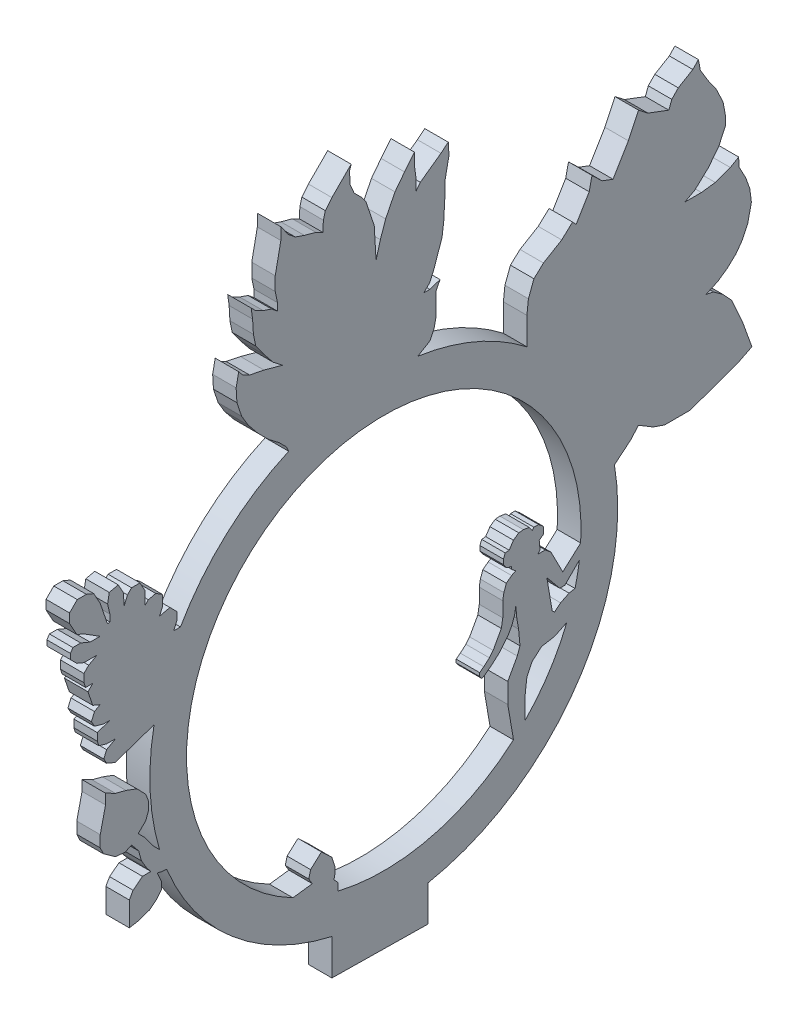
SolidWorks part; units mm, degrees
ref_plane "Plano frontal" through (0, 0, 0) normal (0, 0, 1) x (1, 0, 0)
ref_plane "Plano superior" through (0, 0, 0) normal (0, 1, 0) x (1, 0, 0)
ref_plane "Plano direito" through (0, 0, 0) normal (1, 0, 0) x (0, 0, -1)
sketch "Esboço1" plane through (0, 0, 0) normal (1, 0, 0) x (0, 0, -1)
  line L0 (314.6685, 952.5476) -> (880.0018, 952.5476) construction
  line L1 (226.0307, 496.3943) -> (227.4793, 496.2376)
  line L2 (226.0307, 496.3943) -> (225.0181, 496.664)
  line L3 (225.0181, 496.664) -> (225.5244, 495.5665)
  line L4 (225.5244, 495.5665) -> (226.1393, 494.2335)
  line L5 (226.1393, 494.2335) -> (226.1393, 492.4215)
  line L6 (226.1393, 492.4215) -> (224.673, 490.6933)
  line L7 (224.673, 490.6933) -> (223.0945, 489.4418)
  line L8 (223.0945, 489.4418) -> (220.1515, 488.4404)
  line L9 (220.1515, 488.4404) -> (217.9161, 488.0594)
  line L10 (217.9161, 488.0594) -> (217.9161, 490.0675)
  line L11 (217.9161, 490.0675) -> (217.9161, 492.4215)
  line L12 (217.9161, 492.4215) -> (217.9161, 494.2335)
  line L13 (217.9161, 494.2335) -> (218.8799, 495.9021)
  line L14 (218.8799, 495.9021) -> (220.3037, 497.031)
  line L15 (220.3037, 497.031) -> (221.264, 497.7923)
  line L16 (221.264, 497.7923) -> (222.3516, 497.7923)
  line L17 (222.3516, 497.7923) -> (223.415, 497.7923)
  line L18 (223.415, 497.7923) -> (222.3516, 499.0984)
  line L19 (222.3516, 499.0984) -> (221.0181, 501.3378)
  line L20 (221.0181, 501.3378) -> (220.3037, 503.8906)
  line L21 (220.3037, 503.8906) -> (218.4927, 506.1149)
  line L22 (218.4927, 506.1149) -> (216.8457, 505.3501)
  line L23 (216.8457, 505.3501) -> (214.394, 505.5554)
  line L24 (214.394, 505.5554) -> (211.2787, 507.7765)
  line L25 (211.2787, 507.7765) -> (210.4915, 509.4718)
  line L26 (210.4915, 509.4718) -> (210.4915, 512.4023)
  line L27 (210.4915, 512.4023) -> (211.2787, 515.8271)
  line L28 (211.2787, 515.8271) -> (211.8425, 518.2799)
  line L29 (211.8425, 518.2799) -> (211.8425, 520.8947)
  line L30 (211.8425, 520.8947) -> (214.394, 519.5873)
  line L31 (214.394, 519.5873) -> (217.0721, 518.8876)
  line L32 (217.0721, 518.8876) -> (219.8557, 517.8482)
  line L33 (219.8557, 517.8482) -> (222.0914, 515.5605)
  line L34 (222.0914, 515.5605) -> (222.7723, 513.8107)
  line L35 (222.7723, 513.8107) -> (222.7723, 511.4552)
  line L36 (222.7723, 511.4552) -> (222.0914, 509.6315)
  line L37 (222.0914, 509.6315) -> (220.644, 508.2171)
  line L38 (220.644, 508.2171) -> (220.1932, 507.7765)
  line L39 (220.1932, 507.7765) -> (221.9748, 505.9535)
  line L40 (221.9748, 505.9535) -> (224.0695, 503.1016)
  line L41 (224.0695, 503.1016) -> (225.6449, 501.4895)
  line L42 (229.271, 548.0954) -> (230.9765, 548.0954)
  line L43 (229.271, 548.0954) -> (230.1237, 550.1282)
  line L44 (230.1237, 550.1282) -> (230.1237, 551.9149)
  line L45 (230.1237, 551.9149) -> (228.2793, 553.7593)
  line L46 (228.2793, 553.7593) -> (225.6449, 553.1468)
  line L47 (225.6449, 553.1468) -> (226.3872, 554.9164)
  line L48 (226.3872, 554.9164) -> (226.3872, 557.5866)
  line L49 (226.3872, 557.5866) -> (224.673, 558.6612)
  line L50 (224.673, 558.6612) -> (222.7723, 558.2193)
  line L51 (222.7723, 558.2193) -> (221.9748, 557.4217)
  line L52 (221.9748, 557.4217) -> (221.9748, 560.6046)
  line L53 (221.9748, 560.6046) -> (220.644, 563.006)
  line L54 (220.644, 563.006) -> (218.4927, 563.006)
  line L55 (218.4927, 563.006) -> (217.4416, 561.9549)
  line L56 (217.4416, 561.9549) -> (216.6007, 559.9503)
  line L57 (216.6007, 559.9503) -> (216.3904, 563.006)
  line L58 (216.3904, 563.006) -> (215.084, 565.3636)
  line L59 (215.084, 565.3636) -> (212.7983, 564.8322)
  line L60 (212.7983, 564.8322) -> (212.3649, 562.4805)
  line L61 (212.3649, 562.4805) -> (212.9532, 559.9503)
  line L62 (212.9532, 559.9503) -> (212.9532, 558.2193)
  line L63 (212.9532, 558.2193) -> (212.3491, 558.0789)
  line L64 (212.3491, 558.0789) -> (211.2787, 561.2154)
  line L65 (211.2787, 561.2154) -> (210.4457, 563.6563)
  line L66 (210.4457, 563.6563) -> (208.8513, 566.5335)
  line L67 (208.8513, 566.5335) -> (206.9493, 567.3314)
  line L68 (206.9493, 567.3314) -> (204.6251, 567.3314)
  line L69 (204.6251, 567.3314) -> (202.6573, 565.3636)
  line L70 (202.6573, 565.3636) -> (202.6573, 563.006)
  line L71 (202.6573, 563.006) -> (203.5039, 561.4782)
  line L72 (203.5039, 561.4782) -> (204.5186, 559.6471)
  line L73 (204.5186, 559.6471) -> (206.2431, 558.9237)
  line L74 (206.2431, 558.9237) -> (208.8513, 557.2886)
  line L75 (208.8513, 557.2886) -> (210.4457, 556.2891)
  line L76 (210.4457, 556.2891) -> (207.9003, 556.2891)
  line L77 (207.9003, 556.2891) -> (205.5176, 557.2886)
  line L78 (205.5176, 557.2886) -> (203.5039, 557.2886)
  line L79 (203.5039, 557.2886) -> (202.8773, 556.2891)
  line L80 (202.8773, 556.2891) -> (202.8773, 554.9164)
  line L81 (202.8773, 554.9164) -> (204.5108, 553.2829)
  line L82 (204.5108, 553.2829) -> (206.3207, 552.5236)
  line L83 (206.3207, 552.5236) -> (208.3877, 552.5236)
  line L84 (208.3877, 552.5236) -> (209.6485, 552.5236)
  line L85 (209.6485, 552.5236) -> (207.5389, 551.3546)
  line L86 (207.5389, 551.3546) -> (206.3207, 550.1364)
  line L87 (206.3207, 550.1364) -> (206.3207, 548.0954)
  line L88 (206.3207, 548.0954) -> (206.7581, 546.8136)
  line L89 (206.7581, 546.8136) -> (208.5937, 546.8136)
  line L90 (208.5937, 546.8136) -> (207.3542, 545.5741)
  line L91 (207.3542, 545.5741) -> (207.9003, 543.9738)
  line L92 (207.9003, 543.9738) -> (208.5937, 541.942)
  line L93 (208.5937, 541.942) -> (210.4457, 541.165)
  line L94 (210.4457, 541.165) -> (209.0181, 540.3739)
  line L95 (209.0181, 540.3739) -> (208.2375, 538.5133)
  line L96 (208.2375, 538.5133) -> (209.0181, 537.1047)
  line L97 (209.0181, 537.1047) -> (211.2787, 536.4562)
  line L98 (211.2787, 536.4562) -> (212.9532, 536.4562)
  line L99 (212.9532, 536.4562) -> (209.7319, 535.3569)
  line L100 (209.7319, 535.3569) -> (209.7319, 533.4406)
  line L101 (209.7319, 533.4406) -> (210.1484, 532.2202)
  line L102 (210.1484, 532.2202) -> (212.1159, 531.6557)
  line L103 (212.1159, 531.6557) -> (214.394, 531.6557)
  line L104 (214.394, 531.6557) -> (212.1159, 530.3933)
  line L105 (212.1159, 530.3933) -> (211.3941, 528.6726)
  line L106 (211.3941, 528.6726) -> (212.1159, 527.37)
  line L107 (212.1159, 527.37) -> (214.2987, 526.4543)
  line L108 (214.2987, 526.4543) -> (215.6403, 526.9121)
  line L109 (215.6403, 526.9121) -> (218.2728, 527.8105)
  line L110 (218.2728, 527.8105) -> (220.644, 528.6197)
  line L111 (220.644, 528.6197) -> (224.2371, 529.846)
  line L112 (294.6744, 579.5011) -> (291.6024, 577.667)
  line L113 (294.6744, 579.5011) -> (295.769, 581.6984)
  line L114 (295.769, 581.6984) -> (296.2584, 584.1219)
  line L115 (296.2584, 584.1219) -> (296.2584, 586.9013)
  line L116 (296.2584, 586.9013) -> (296.2584, 589.7394)
  line L117 (296.2584, 589.7394) -> (297.2801, 591.7906)
  line L118 (297.2801, 591.7906) -> (294.6744, 590.9177)
  line L119 (294.6744, 590.9177) -> (293.1384, 590.9177)
  line L120 (293.1384, 590.9177) -> (294.6744, 592.4537)
  line L121 (294.6744, 592.4537) -> (295.769, 594.997)
  line L122 (295.769, 594.997) -> (296.7693, 597.9047)
  line L123 (296.7693, 597.9047) -> (297.7957, 600.8885)
  line L124 (297.7957, 600.8885) -> (298.228, 604.215)
  line L125 (298.228, 604.215) -> (298.4491, 608.2317)
  line L126 (298.4491, 608.2317) -> (298.6014, 610.9992)
  line L127 (298.6014, 610.9992) -> (298.6014, 613.3113)
  line L128 (298.6014, 613.3113) -> (299.2076, 616.3129)
  line L129 (299.2076, 616.3129) -> (299.5664, 618.0897)
  line L130 (299.5664, 618.0897) -> (299.387, 621.1313)
  line L131 (299.387, 621.1313) -> (297.5121, 619.6105)
  line L132 (297.5121, 619.6105) -> (294.6744, 617.5676)
  line L133 (294.6744, 617.5676) -> (292.248, 615.8207)
  line L134 (292.248, 615.8207) -> (291.1177, 614.3512)
  line L135 (291.1177, 614.3512) -> (291.1177, 617.5676)
  line L136 (291.1177, 617.5676) -> (290.7592, 620.1246)
  line L137 (290.7592, 620.1246) -> (290.7592, 623.2393)
  line L138 (290.7592, 623.2393) -> (288.2265, 620.1246)
  line L139 (288.2265, 620.1246) -> (285.7743, 616.9368)
  line L140 (285.7743, 616.9368) -> (283.3926, 612.1552)
  line L141 (283.3926, 612.1552) -> (282.0428, 608.2317)
  line L142 (282.0428, 608.2317) -> (280.9412, 604.215)
  line L143 (280.9412, 604.215) -> (280.6464, 609.2117)
  line L144 (280.6464, 609.2117) -> (280.4728, 612.1552)
  line L145 (280.4728, 612.1552) -> (279.4464, 615.219)
  line L146 (279.4464, 615.219) -> (278.337, 618.5307)
  line L147 (278.337, 618.5307) -> (277.3984, 619.8343)
  line L148 (277.3984, 619.8343) -> (275.3376, 621.8951)
  line L149 (275.3376, 621.8951) -> (274.3389, 624.2432)
  line L150 (274.3389, 624.2432) -> (274.1526, 627.4016)
  line L151 (274.1526, 627.4016) -> (274.5854, 628.6599)
  line L152 (274.5854, 628.6599) -> (271.5914, 625.6658)
  line L153 (271.5914, 625.6658) -> (269.6598, 623.7343)
  line L154 (269.6598, 623.7343) -> (267.9911, 621.6819)
  line L155 (267.9911, 621.6819) -> (267.4843, 619.8343)
  line L156 (267.4843, 619.8343) -> (267.3394, 617.2013)
  line L157 (267.3394, 617.2013) -> (265.5558, 618.0897)
  line L158 (265.5558, 618.0897) -> (262.628, 618.8927)
  line L159 (262.628, 618.8927) -> (260.3249, 619.685)
  line L160 (260.3249, 619.685) -> (258.5461, 621.1313)
  line L161 (258.5461, 621.1313) -> (256.6195, 623.8075)
  line L162 (256.6195, 623.8075) -> (256.6195, 620.7581)
  line L163 (256.6195, 620.7581) -> (255.7477, 616.4417)
  line L164 (255.7477, 616.4417) -> (255.1914, 613.6871)
  line L165 (255.1914, 613.6871) -> (255.1914, 610.1935)
  line L166 (255.1914, 610.1935) -> (255.7477, 607.4556)
  line L167 (255.7477, 607.4556) -> (255.7477, 605.5759)
  line L168 (255.7477, 605.5759) -> (254.2637, 606.7826)
  line L169 (254.2637, 606.7826) -> (252.0977, 607.5278)
  line L170 (252.0977, 607.5278) -> (250.163, 608.4915)
  line L171 (250.163, 608.4915) -> (249.039, 609.6155)
  line L172 (249.039, 609.6155) -> (249.4088, 606.9775)
  line L173 (249.4088, 606.9775) -> (249.6127, 603.5206)
  line L174 (249.6127, 603.5206) -> (250.198, 600.64)
  line L175 (250.198, 600.64) -> (252.3077, 597.7096)
  line L176 (252.3077, 597.7096) -> (254.6567, 594.8137)
  line L177 (254.6567, 594.8137) -> (257.0855, 592.9453)
  line L178 (257.0855, 592.9453) -> (252.3077, 594.2557)
  line L179 (252.3077, 594.2557) -> (248.6367, 594.997)
  line L180 (248.6367, 594.997) -> (246.8705, 595.8768)
  line L181 (246.8705, 595.8768) -> (245.857, 597.1264)
  line L182 (245.857, 597.1264) -> (245.2012, 593.8795)
  line L183 (245.2012, 593.8795) -> (245.4012, 590.49)
  line L184 (245.4012, 590.49) -> (246.6035, 586.9013)
  line L185 (246.6035, 586.9013) -> (248.2629, 584.1219)
  line L186 (248.2629, 584.1219) -> (250.7067, 581.109)
  line L187 (250.7067, 581.109) -> (253.4822, 578.3335)
  line L188 (253.4822, 578.3335) -> (256.1836, 576.2554)
  line L189 (256.1836, 576.2554) -> (258.0706, 574.3684)
  line L190 (264.665, 474.4605) -> (259.7084, 473.8246)
  line L191 (264.665, 474.4605) -> (263.7635, 475.9377)
  line L192 (263.7635, 475.9377) -> (264.2142, 477.8)
  line L193 (264.2142, 477.8) -> (267.0019, 480.3155)
  line L194 (267.0019, 480.3155) -> (269.6598, 477.8)
  line L195 (269.6598, 477.8) -> (270.4752, 475.1991)
  line L196 (270.4752, 475.1991) -> (270.4752, 473.8246)
  line L197 (270.4752, 473.8246) -> (270.1762, 472.5893)
  line L198 (270.1762, 472.5893) -> (271.2643, 471.3835)
  line L199 (271.2643, 471.3835) -> (271.2643, 469.5275)
  line L200 (319.4649, 568.8907) -> (319.4649, 565.8203)
  line L201 (319.4649, 568.8907) -> (319.4649, 572.7931)
  line L202 (319.4649, 572.7931) -> (319.8616, 576.2554)
  line L203 (319.8616, 576.2554) -> (321.2653, 579.98)
  line L204 (321.2653, 579.98) -> (323.7053, 582.2442)
  line L205 (323.7053, 582.2442) -> (328.3613, 585.0185)
  line L206 (328.3613, 585.0185) -> (331.1301, 587.5879)
  line L207 (331.1301, 587.5879) -> (332.044, 586.6031)
  line L208 (332.044, 586.6031) -> (333.7582, 589.466)
  line L209 (333.7582, 589.466) -> (335.375, 592.1661)
  line L210 (335.375, 592.1661) -> (336.098, 595.4242)
  line L211 (336.098, 595.4242) -> (338.6626, 592.9453)
  line L212 (338.6626, 592.9453) -> (340.73, 592.1661)
  line L213 (340.73, 592.1661) -> (341.4738, 591.8858)
  line L214 (341.4738, 591.8858) -> (342.7135, 593.9562)
  line L215 (342.7135, 593.9562) -> (345.3904, 598.4268)
  line L216 (345.3904, 598.4268) -> (347.9672, 603.9288)
  line L217 (347.9672, 603.9288) -> (350.3868, 602.0525)
  line L218 (350.3868, 602.0525) -> (353.7499, 600.785)
  line L219 (353.7499, 600.785) -> (355.7248, 600.0407)
  line L220 (355.7248, 600.0407) -> (356.483, 602.0525)
  line L221 (356.483, 602.0525) -> (358.1389, 603.7657)
  line L222 (358.1389, 603.7657) -> (361.8525, 605.9785)
  line L223 (361.8525, 605.9785) -> (363.2803, 607.4556)
  line L224 (363.2803, 607.4556) -> (363.7637, 604.8721)
  line L225 (363.7637, 604.8721) -> (365.6096, 601.7742)
  line L226 (365.6096, 601.7742) -> (367.9605, 598.4268)
  line L227 (367.9605, 598.4268) -> (369.5943, 594.8137)
  line L228 (369.5943, 594.8137) -> (370.1421, 591.8858)
  line L229 (370.1421, 591.8858) -> (370.1421, 589.2264)
  line L230 (370.1421, 589.2264) -> (368.4876, 585.6936)
  line L231 (368.4876, 585.6936) -> (365.8129, 582.2442)
  line L232 (365.8129, 582.2442) -> (362.3034, 578.9875)
  line L233 (362.3034, 578.9875) -> (359.8175, 577.667)
  line L234 (359.8175, 577.667) -> (364.0581, 577.667)
  line L235 (364.0581, 577.667) -> (367.5914, 578.1177)
  line L236 (367.5914, 578.1177) -> (371.4337, 579.5011)
  line L237 (371.4337, 579.5011) -> (373.558, 580.7669)
  line L238 (373.558, 580.7669) -> (373.67, 578.4565)
  line L239 (373.67, 578.4565) -> (375.3528, 575.2887)
  line L240 (375.3528, 575.2887) -> (376.4007, 572.3783)
  line L241 (376.4007, 572.3783) -> (376.8162, 569.121)
  line L242 (376.8162, 569.121) -> (375.8767, 564.8875)
  line L243 (375.8767, 564.8875) -> (374.5114, 561.9722)
  line L244 (374.5114, 561.9722) -> (372.8509, 559.6471)
  line L245 (372.8509, 559.6471) -> (370.6304, 557.5866)
  line L246 (370.6304, 557.5866) -> (368.2516, 555.9159)
  line L247 (368.2516, 555.9159) -> (365.2057, 554.5386)
  line L248 (365.2057, 554.5386) -> (367.1502, 554.1071)
  line L249 (367.1502, 554.1071) -> (369.441, 552.471)
  line L250 (369.441, 552.471) -> (371.7407, 549.9929)
  line L251 (371.7407, 549.9929) -> (373.4567, 546.1978)
  line L252 (373.4567, 546.1978) -> (374.5114, 543.8654)
  line L253 (374.5114, 543.8654) -> (375.8767, 540.0733)
  line L254 (375.8767, 540.0733) -> (376.9455, 537.1047)
  line L255 (376.9455, 537.1047) -> (373.4567, 535.3569)
  line L256 (373.4567, 535.3569) -> (368.4876, 533.5678)
  line L257 (368.4876, 533.5678) -> (364.0581, 531.973)
  line L258 (364.0581, 531.973) -> (361.2054, 530.9459)
  line L259 (361.2054, 530.9459) -> (358.1389, 530.9459)
  line L260 (358.1389, 530.9459) -> (354.6457, 530.9459)
  line L261 (354.6457, 530.9459) -> (351.6805, 531.973)
  line L262 (351.6805, 531.973) -> (349.0468, 533.5678)
  line L263 (349.0468, 533.5678) -> (347.9672, 534.2215)
  line L264 (347.9672, 534.2215) -> (346.0051, 531.973)
  line L265 (346.0051, 531.973) -> (343.4237, 529.846)
  line L266 (343.4237, 529.846) -> (341.8304, 528.5331)
  line L267 (269.6598, 451.1002) -> (269.6598, 460.2786)
  line L268 (294.2526, 450.7489) -> (294.2526, 459.8753)
  line L269 (269.6598, 451.1002) -> (294.2526, 450.7489)
  line L270 (328.6293, 511.4552) -> (333.2103, 515.5605)
  line L271 (327.8561, 508.2171) -> (329.1434, 508.2171)
  line L272 (329.1434, 508.2171) -> (332.8635, 511.9372)
  line L273 (327.8561, 508.2171) -> (324.5663, 512.2155)
  line L274 (324.5663, 512.2155) -> (325.9304, 504.1893)
  line L275 (325.9304, 504.1893) -> (326.5212, 503.5985)
  line L276 (326.5212, 503.5985) -> (328.0803, 504.8812)
  line L277 (328.0803, 504.8812) -> (330.2376, 505.9535)
  line L278 (330.2376, 505.9535) -> (331.7662, 506.2133)
  line L279 (328.6293, 511.4552) -> (326.8341, 514.9463)
  line L280 (326.8341, 514.9463) -> (325.6046, 517.3375)
  line L281 (325.6046, 517.3375) -> (324.1518, 518.5459)
  line L282 (324.1518, 518.5459) -> (322.2533, 518.5459)
  line L283 (322.2533, 518.5459) -> (322.8255, 519.2338)
  line L284 (322.8255, 519.2338) -> (322.6212, 521.4583)
  line L285 (322.6212, 521.4583) -> (323.7053, 522.225)
  line L286 (323.7053, 522.225) -> (323.7053, 523.9775)
  line L287 (323.7053, 523.9775) -> (322.4556, 525.0169)
  line L288 (322.4556, 525.0169) -> (321.2653, 525.0169)
  line L289 (321.2653, 525.0169) -> (320.833, 524.4972)
  line L290 (320.833, 524.4972) -> (320.078, 525.5649)
  line L291 (320.078, 525.5649) -> (318.5695, 525.8236)
  line L292 (318.5695, 525.8236) -> (317.3887, 525.7151)
  line L293 (317.3887, 525.7151) -> (316.0339, 524.7571)
  line L294 (316.0339, 524.7571) -> (315.1083, 523.36)
  line L295 (315.1083, 523.36) -> (314.9368, 523.1012)
  line L296 (314.9368, 523.1012) -> (313.911, 523.007)
  line L297 (313.911, 523.007) -> (313.4905, 521.8417)
  line L298 (313.4905, 521.8417) -> (313.4905, 520.6198)
  line L299 (313.4905, 520.6198) -> (314.2207, 519.5873)
  line L300 (314.2207, 519.5873) -> (315.2004, 519.2338)
  line L301 (315.2004, 519.2338) -> (315.5711, 519.2338)
  line L302 (315.5711, 519.2338) -> (315.5711, 518.5459)
  line L303 (315.5711, 518.5459) -> (316.2975, 517.9417)
  line L304 (316.2975, 517.9417) -> (316.5875, 517.7005)
  line L305 (316.5875, 517.7005) -> (315.5711, 517.1778)
  line L306 (315.5711, 517.1778) -> (314.2207, 516.1419)
  line L307 (314.2207, 516.1419) -> (313.5885, 514.3898)
  line L308 (313.5885, 514.3898) -> (313.3066, 512.7465)
  line L309 (313.3066, 512.7465) -> (313.3066, 508.931)
  line L310 (313.3066, 508.931) -> (312.9389, 506.7868)
  line L311 (312.9389, 506.7868) -> (311.7366, 504.5951)
  line L312 (311.7366, 504.5951) -> (310.8467, 502.9728)
  line L313 (310.8467, 502.9728) -> (309.8851, 501.8167)
  line L314 (309.8851, 501.8167) -> (308.4624, 500.5594)
  line L315 (308.4624, 500.5594) -> (307.4236, 499.7626)
  line L316 (307.4236, 499.7626) -> (307.4236, 498.8895)
  line L317 (307.4236, 498.8895) -> (307.943, 498.2124)
  line L318 (307.943, 498.2124) -> (308.7729, 498.6392)
  line L319 (308.7729, 498.6392) -> (310.5155, 499.9759)
  line L320 (310.5155, 499.9759) -> (312.3377, 501.5863)
  line L321 (312.3377, 501.5863) -> (313.4476, 502.9206)
  line L322 (313.4476, 502.9206) -> (314.7105, 504.439)
  line L323 (314.7105, 504.439) -> (315.6204, 506.0977)
  line L324 (315.6204, 506.0977) -> (316.3203, 508.0375)
  line L325 (316.3203, 508.0375) -> (316.6382, 509.8908)
  line L326 (316.6382, 509.8908) -> (316.8975, 507.0676)
  line L327 (316.8975, 507.0676) -> (317.3442, 504.439)
  line L328 (317.3442, 504.439) -> (317.7005, 500.5594)
  line L329 (317.7005, 500.5594) -> (317.0077, 498.6392)
  line L330 (317.0077, 498.6392) -> (315.5063, 495.9021)
  line L331 (315.5063, 495.9021) -> (314.5909, 494.2335)
  line L332 (314.5909, 494.2335) -> (314.5909, 489.147)
  line L333 (314.5909, 489.147) -> (315.0486, 486.4541)
  line L334 (315.0486, 486.4541) -> (315.6596, 482.8588)
  line L335 (315.6596, 482.8588) -> (316.0457, 480.5869)
  line L336 (329.6667, 499.7626) -> (326.5212, 498.2124)
  line L337 (326.5212, 498.2124) -> (323.2313, 497.6533)
  line L338 (323.2313, 497.6533) -> (320.833, 495.5665)
  line L339 (320.833, 495.5665) -> (319.4649, 492.7665)
  line L340 (319.4649, 492.7665) -> (318.9833, 488.6988)
  line L341 (318.9833, 488.6988) -> (318.9833, 483.3662)
  line L342 (258.0706, 574.3684) -> (258.6177, 573.1391)
  arc A0 (333.2103, 515.5605) -> (259.7084, 473.8246) centre (282.9149, 518.5459) ccw
  arc A1 (258.6177, 573.1391) -> (230.9765, 548.0954) centre (282.9149, 518.5459) ccw
  arc A2 (319.4649, 565.8203) -> (291.6024, 577.667) centre (282.9149, 518.5459) ccw
  arc A3 (331.7662, 506.2133) -> (332.8635, 511.9372) centre (282.9149, 518.5459) ccw
  arc A4 (318.9833, 483.3662) -> (329.6667, 499.7626) centre (282.9149, 518.5459) ccw
  arc A5 (271.2643, 469.5275) -> (316.0457, 480.5869) centre (282.9149, 518.5459) ccw
  arc A6 (294.2526, 459.8753) -> (341.8304, 528.5331) centre (282.9149, 518.5459) ccw
  arc A7 (227.4793, 496.2376) -> (269.6598, 460.2786) centre (282.9149, 518.5459) ccw
  arc A8 (224.2371, 529.846) -> (225.6449, 501.4895) centre (282.9149, 518.5459) ccw
extrude "Ressalto-extrusão1" add sketch "Esboço1" along normal blind 6
